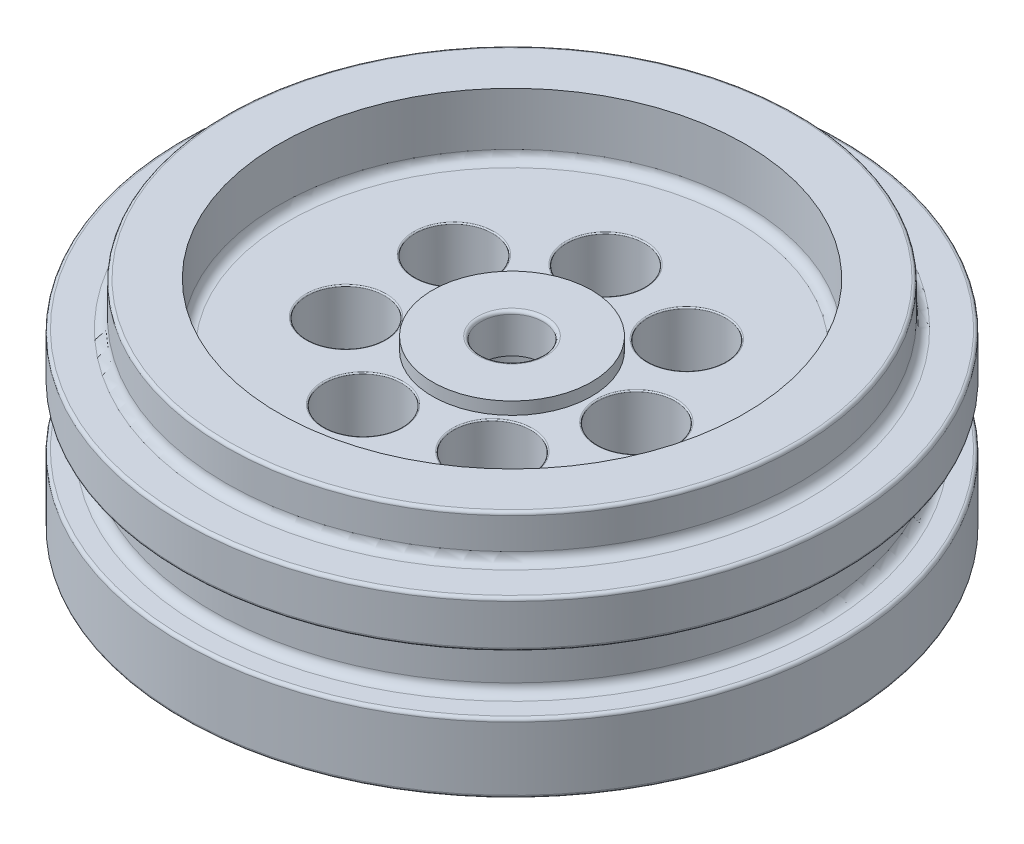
SolidWorks part; units mm, degrees
ref_plane "Front" through (0, 0, 0) normal (0, 0, 1) x (1, 0, 0)
ref_plane "Top" through (0, 0, 0) normal (0, 1, 0) x (1, 0, 0)
ref_plane "Right" through (0, 0, 0) normal (1, 0, 0) x (0, 0, -1)
sketch "Sketch1" plane through (0, 0, 0) normal (0, 0, 1) x (1, 0, 0)
  line L0 (0, 0) -> (0, 7.4584) construction
  line L1 (0, 0) -> (13.462, 0)
  line L2 (13.462, 0) -> (13.462, 7.112)
  line L3 (13.462, 7.112) -> (11.684, 7.112)
  line L4 (11.684, 8.89) -> (0, 8.89)
  line L5 (0, 8.89) -> (0, 0)
  line L6 (1.27, 6.858) -> (1.27, 5.2578) construction
  line L7 (11.3938, 0) -> (9.1548, 0) construction
  line L8 (11.3938, 0) -> (11.3938, 1.3208) construction
  line L9 (11.3938, 1.3208) -> (9.1548, 1.3208) construction
  line L10 (9.1548, 0) -> (9.1548, 1.3208) construction
  line L11 (13.462, 5.2045) -> (12.2174, 5.2045) construction
  line L12 (13.462, 5.2045) -> (13.462, 2.8423) construction
  line L13 (13.462, 2.8423) -> (12.2174, 2.8423) construction
  line L14 (12.2174, 5.2045) -> (12.2174, 2.8423) construction
  line L15 (1.27, 5.2578) -> (2.159, 5.2578) construction
  line L16 (2.159, 5.2578) -> (2.159, 0) construction
  line L17 (3.4925, 6.35) -> (3.4925, 0) construction
  line L18 (6.6675, 6.35) -> (6.6675, 0) construction
  line L19 (3.4925, 6.35) -> (6.6675, 6.35) construction
  line L20 (3.2512, 6.35) -> (9.525, 6.35) construction
  line L21 (9.525, 6.35) -> (9.525, 8.89) construction
  line L22 (1.27, 6.858) -> (3.2512, 6.858) construction
  line L23 (3.2512, 6.858) -> (3.2512, 6.35) construction
  line L24 (11.684, 7.112) -> (11.684, 8.89)
  line L25 (9.1548, 1.3208) -> (9.7428, 0) construction
  line L26 (9.7428, 0) -> (11.3938, 0) construction
  line L27 (9.3853, 1.3208) -> (11.1633, 1.3208) construction
  point P24 (5.08, 6.35)
  point P25 (10.2743, 1.3208)
  point P30 (10.5683, 0)
  point P31 (0, 0)
  point P36 (0, 0)
  point P37 (23.4367, 0)
  point P38 (18.8479, 0)
  point P39 (18.1539, 0)
  point P40 (17.4532, 1.3208)
  point P41 (0, 0)
  point P42 (17.4532, -0.4449)
  point P43 (8.9727, 0)
  point P44 (0, 0)
  point P45 (11.5759, -0.0461)
  point P46 (0, 0)
  point P47 (0, 0)
  point P48 (10.2743, 1.8314)
  point P49 (0, 0)
  point P50 (10.2743, 1.3208)
  dimension "D1" = 26.924
  dimension "D2" = 2.54
  dimension "D3" = 8.89
  dimension "D4" = 1.778
  dimension "D5" = 2.3622
  dimension "D6" = 18.3095
  dimension "D7" = 2.2391
  dimension "D8" = 24.4348
  dimension "D9" = 2.8423
  dimension "D10" = 1.2446
  dimension "D11" = 1.3208
  dimension "D12" = 1.6002
  dimension "D13" = 4.318
  dimension "D14" = 3.175
  dimension "D15" = 1.3335
  dimension "D16" = 2.4873
  dimension "D17" = 10.16
  dimension "D18" = 1.778
  dimension "D19" = 13.335
  dimension "D20" = 19.05
  dimension "D21" = 2.54
  dimension "D22" = 6.35
  dimension "D23" = 2.0682
  dimension "D24" = 2.54
  dimension "D25" = 0.508
  dimension "D26" = 6.5024
  dimension "D27" = 66
  dimension "D28" = 1.651
  dimension "D29" = 21.1367
  dimension "D30" = 18.7706
  dimension "D31" = 22.3266
sketch "Sketch2" plane through (0, 0, 0) normal (0, 0, 1) x (1, 0, 0)
  line L0 (11.684, 8.89) -> (0, 8.89) construction
  line L1 (0, 8.89) -> (0, 0) construction
  line L2 (0, 0) -> (13.462, 0) construction
  line L3 (13.462, 0) -> (13.462, 7.112) construction
  line L5 (11.684, 8.89) -> (0, 8.89)
  line L6 (0, 8.89) -> (0, 0)
  line L7 (0, 0) -> (13.462, 0)
  line L8 (13.462, 0) -> (13.462, 7.112)
  line L10 (13.462, 7.112) -> (11.684, 7.112) construction
  line L11 (11.684, 7.112) -> (11.684, 8.89) construction
  line L12 (13.462, 7.112) -> (11.684, 7.112)
  line L13 (11.684, 7.112) -> (11.684, 8.89)
revolve "Revolve1" add sketch "Sketch2" angle 360 about L0
sketch "Sketch3" plane through (0, 0, 0) normal (0, 0, 1) x (1, 0, 0)
  line L0 (2.159, 5.2578) -> (2.159, 0) construction
  line L1 (1.27, 6.858) -> (1.27, 5.2578) construction
  line L2 (1.27, 5.2578) -> (2.159, 5.2578) construction
  line L3 (2.159, 5.2578) -> (2.159, 0)
  line L4 (1.27, 6.858) -> (1.27, 5.2578)
  line L5 (1.27, 5.2578) -> (2.159, 5.2578)
  line L8 (0, 0) -> (2.159, 0)
  line L9 (1.27, 6.858) -> (3.2512, 6.858) construction
  line L10 (1.27, 6.858) -> (3.2512, 6.858)
  line L11 (0, 8.89) -> (0, 0) construction
  line L12 (0, 8.89) -> (0, 0)
  line L13 (11.684, 8.89) -> (0, 8.89) construction
  line L14 (3.2512, 8.89) -> (0, 8.89)
  line L15 (3.2512, 6.858) -> (3.2512, 8.89)
revolve "Cut-Revolve1" cut sketch "Sketch3" angle 360 about L0
sketch "Sketch4" plane through (0, 0, 0) normal (0, 0, 1) x (1, 0, 0)
  line L0 (9.525, 6.35) -> (9.525, 8.89) construction
  line L1 (3.2512, 6.35) -> (9.525, 6.35) construction
  line L2 (9.525, 6.35) -> (9.525, 8.89)
  line L3 (3.2512, 6.35) -> (9.525, 6.35)
  line L4 (3.2512, 6.35) -> (3.2512, 8.89)
  line L6 (3.2512, 8.89) -> (9.525, 8.89)
revolve "Cut-Revolve2" cut sketch "Sketch4" angle 360 about L0
sketch "Sketch5" plane through (0, 0, 0) normal (0, 0, 1) x (1, 0, 0)
  line L0 (9.1548, 0) -> (9.1548, 1.3208) construction
  line L1 (11.3938, 1.3208) -> (9.1548, 1.3208) construction
  line L2 (11.3938, 0) -> (11.3938, 1.3208) construction
  line L3 (11.3938, 0) -> (9.1548, 0) construction
  line L4 (9.1548, 0) -> (9.1548, 1.3208)
  line L5 (11.3938, 1.3208) -> (9.1548, 1.3208)
  line L6 (11.3938, 0) -> (11.3938, 1.3208)
  line L7 (11.3938, 0) -> (9.1548, 0)
revolve "Cut-Revolve3" cut sketch "Sketch5" angle 360 about L0
sketch "Sketch6" plane through (0, 0, 0) normal (0, 0, 1) x (1, 0, 0)
  line L0 (13.462, 5.2045) -> (12.2174, 5.2045) construction
  line L1 (12.2174, 5.2045) -> (12.2174, 2.8423) construction
  line L2 (13.462, 2.8423) -> (12.2174, 2.8423) construction
  line L3 (13.462, 5.2045) -> (13.462, 2.8423) construction
  line L4 (13.462, 5.2045) -> (12.2174, 5.2045)
  line L5 (12.2174, 5.2045) -> (12.2174, 2.8423)
  line L6 (13.462, 2.8423) -> (12.2174, 2.8423)
  line L7 (13.462, 5.2045) -> (13.462, 2.8423)
revolve "Cut-Revolve4" cut sketch "Sketch6" angle 360 about L0
sketch "Sketch9" plane through (0, 0, 0) normal (0, 1, 0) x (1, 0, 0)
  circle A0 centre (0, 0) radius 6.985
  dimension "D1" = 13.97
extrude "Cut-Extrude1" cut sketch "Sketch9" along normal blind 2.54
sketch "Sketch7" plane through (0, 0, 0) normal (0, 1, 0) x (1, 0, 0)
  point P0 (5.08, 0)
hole_wizard "1/8 (0.125) Diameter Hole1" positions "Sketch7" profile "Sketch8" hole size "1/8" standard "ANSI Inch"
sketch "Sketch8" plane through (5.08, 0, 0) normal (1, 0, 0) x (0, 0, -1)
  line L0 (0, 0) -> (0, 8.89)
  line L1 (0, 8.89) -> (1.5875, 8.89)
  line L2 (1.5875, 8.89) -> (1.5875, 0)
  line L5 (1.5875, 0) -> (0, 0)
  line L11 (0, -6.35) -> (0, 107.95) construction
  dimension "Thru Hole Dia." = 3.175
  dimension "Thru Hole Depth" = 8.89
pattern_circular "CirPattern1" count 7 over 360 about axis through (0, 0, 0) along (0, 1, 0) of "1/8 (0.125) Diameter Hole1"
fillet "leadin_radius" radius 0.127 1 edges at (0, 6.858, -1.27)
draft "Draft1" type of draft neutral plane draft angle 24 faces to draft 1 parameters "D1"=24
fillet "oring1_gland_radius" radius 0.381 2 edges at (0, 1.3208, -9.1548) (0, 1.3208, -11.3938)
fillet "oring1_opening_radius" radius 0.127 2 edges at (0, 0, -9.7428) (0, 0, -11.3938)
fillet "oring2_gland_radius" radius 0.381 2 edges at (0, 5.2045, -12.2174) (0, 2.8423, -12.2174)
fillet "oring2_opening_radius" radius 0.127 2 edges at (0, 5.2045, -13.462) (0, 2.8423, -13.462)
fillet "Fillet1" radius 0.0508 7 edges at (5.08, 6.35, -1.5875) (3.1673, 6.35, 2.3842) (-1.1304, 6.35, 3.3651) (-4.5769, 6.35, 0.6166) (-4.5769, 6.35, -3.7916) (-1.1304, 6.35, -6.5401) (3.1673, 6.35, -5.5592)
fillet "Fillet2" radius 0.381 2 edges at (0, 7.112, -11.684) (0, 6.35, -9.525)
fillet "Fillet3" radius 0.127 3 edges at (0, 0, -13.462) (0, 8.89, -11.684) (0, 7.112, -13.462)
